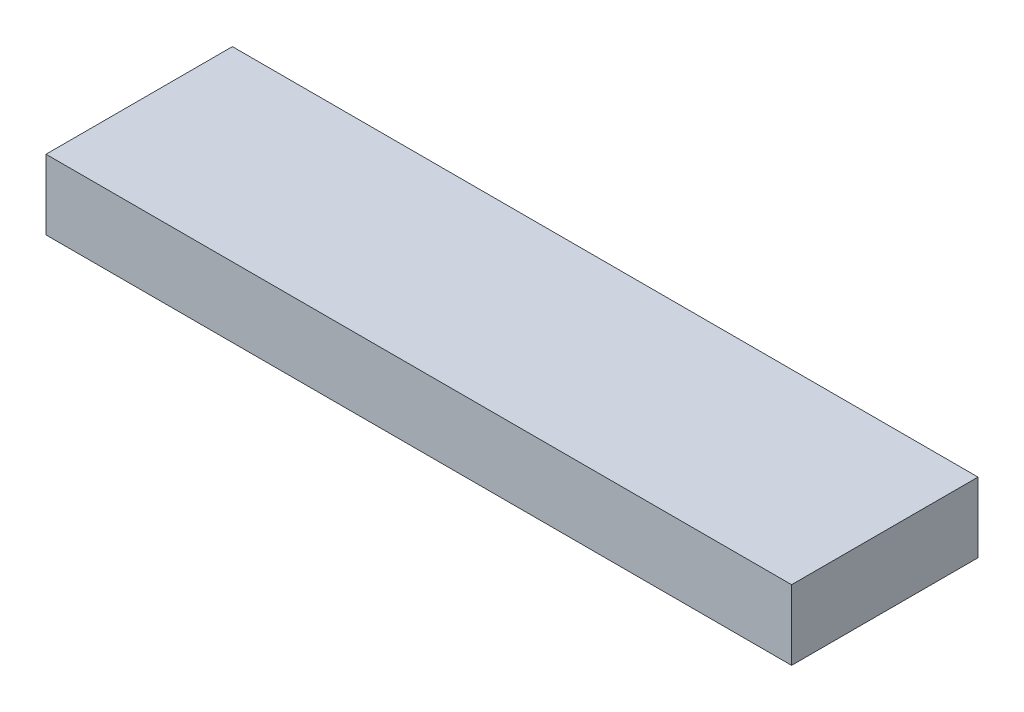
SolidWorks part; units mm, degrees
ref_plane "前视基准面" through (0, 0, 0) normal (0, 0, 1) x (1, 0, 0)
ref_plane "上视基准面" through (0, 0, 0) normal (0, 1, 0) x (1, 0, 0)
ref_plane "右视基准面" through (0, 0, 0) normal (1, 0, 0) x (0, 0, -1)
sketch "草图1" plane through (0, 0, 0) normal (1, 0, 0) x (0, 0, -1)
  line L0 (0, -57.004) -> (0, 99.5563) construction
  line L1 (-20, 15) -> (20, 15)
  line L2 (-20, 15) -> (-20, 0)
  line L3 (-20, 0) -> (20, 0)
  line L4 (20, 15) -> (20, 0)
  dimension "D1" = 40
  dimension "D2" = 15
extrude "拉伸1" add sketch "草图1" along normal blind 160
